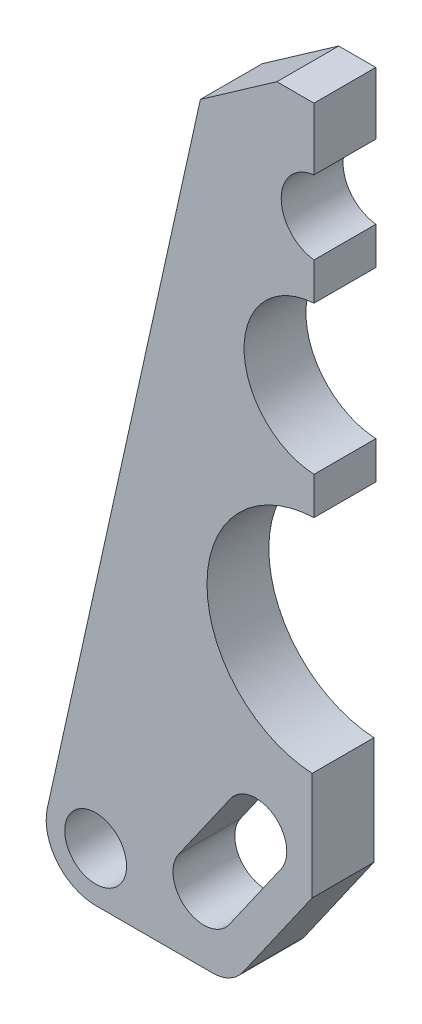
SolidWorks part; units mm, degrees
ref_plane "Plane1" through (0, 0, 0) normal (0, 0, 1) x (1, 0, 0)
ref_plane "Plane2" through (0, 0, 0) normal (0, 1, 0) x (1, 0, 0)
ref_plane "Plane3" through (0, 0, 0) normal (1, 0, 0) x (0, 0, -1)
sketch "Sketch1" plane through (0, 0, 0) normal (0, 0, 1) x (1, 0, 0)
  line L0 (-0.35, 46.0205) -> (-0.35, 42.9898)
  line L1 (-6.9973, -8) -> (-0.5, 1.2791)
  line L2 (-6.9973, -8) -> (-18, -8)
  line L3 (-9.25, -2.5) -> (-5.0488, 3.5) construction
  line L4 (-0.35, 51.9795) -> (-0.35, 57)
  line L5 (0, 37.9726) -> (0, 0) construction
  line L6 (-21.9052, -3.1342) -> (-9.5336, 52.6702)
  line L7 (-3.35, 57) -> (-0.35, 57)
  line L8 (-11.2979, -1.0661) -> (-7.0966, 4.9339)
  line L9 (-3.35, 57) -> (-9.5336, 52.6702)
  line L10 (-7.2021, -3.9339) -> (-3.0009, 2.0661)
  line L11 (-0.35, 31.0102) -> (-0.35, 27.9795)
  line L12 (-0.5, 10.0002) -> (-0.5, 1.2791)
  line L14 (-0.9047, 6.4714) -> (-2.8409, 2.3192) construction
  arc A0 (-11.2979, -1.0661) -> (-7.2021, -3.9339) centre (-9.25, -2.5) ccw
  arc A1 (-3.0009, 2.0661) -> (-7.0966, 4.9339) centre (-5.0488, 3.5) ccw
  circle A2 centre (-18, -4) radius 2.5
  arc A3 (-21.9052, -3.1342) -> (-18, -8) centre (-18, -4) ccw
  arc A4 (-0.35, 51.9795) -> (-0.35, 46.0205) centre (0, 49) ccw
  arc A5 (-0.35, 42.9898) -> (-0.35, 31.0102) centre (0, 37) ccw
  arc A7 (-0.35, 27.9795) -> (-0.5, 10.0002) centre (0, 18.9863) ccw
  dimension "D6" = 5
  dimension "D7" = 8
  dimension "D12" = 6
  dimension "D14" = 3
  dimension "D17" = 12
  dimension "D4" = 5
  dimension "D15" = 8
  dimension "D16" = 0.35
  dimension "D3" = 145
  dimension "D9" = 6
  dimension "D25" = 18
  dimension "D5" = 18
  dimension "D8" = 2.5
  dimension "D10" = 9.25
  dimension "D11" = 35
  dimension "D13" = 12.5
  dimension "D18" = 65
  dimension "D19" = 12
  dimension "D20" = 5
  dimension "D28" = 1
  dimension "D29" = 4
extrude "Base-Extrude" add sketch "Sketch1" along normal blind 5
chamfer "Chamfer1" [suppressed] distance 2 angle 30
fillet "Fillet1" radius 3 1 edges at (-6.9973, -8, 2.5)
sketch "Sketch2" [suppressed] plane through (0, 0, 0) normal (0, 0, -1) x (-1, 0, 0)
  line L0 (6.1015, -6.7207) -> (1.6547, -0.37) construction
  line L2 (7.2021, -3.9339) -> (3.0009, 2.0661) construction
  line L6 (0.5, 3.3712) -> (4, -1.6273)
  line L7 (0.5, 10.0002) -> (0.5, 1.2791) construction
  line L8 (4, -1.6273) -> (4, -6.6288)
  line L9 (4, -6.6288) -> (-3.5, -6.6288)
  line L10 (-3.5, -6.6288) -> (-3.5, 3.3712)
  line L11 (-3.5, 3.3712) -> (0.5, 3.3712)
  dimension "D1" = 1.3
  dimension "D2" = 4
  dimension "D3" = 10
  dimension "D4" = 4
extrude "Cut-Extrude1" [suppressed] cut sketch "Sketch2" against normal through all
fillet "Fillet3" [suppressed] radius 1.5
